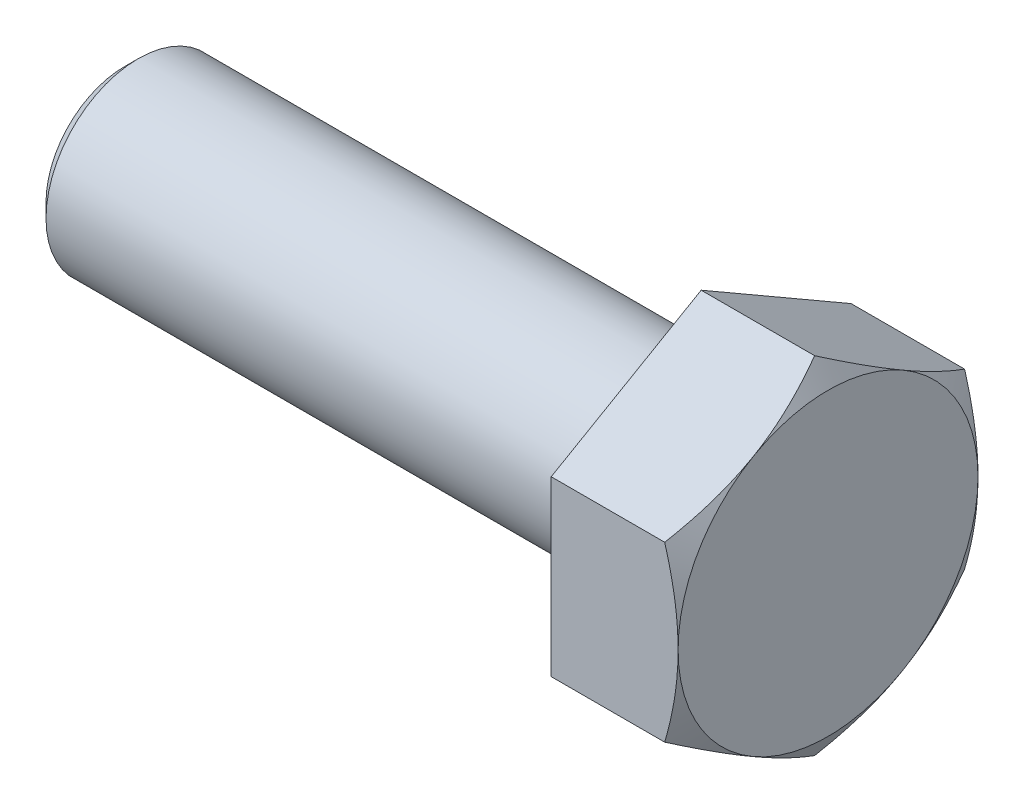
SolidWorks part; units mm, degrees
ref_plane "Plan1" through (0, 0, 0) normal (0, 0, 1) x (1, 0, 0)
ref_plane "Plan2" through (0, 0, 0) normal (0, 1, 0) x (1, 0, 0)
ref_plane "Plan3" through (0, 0, 0) normal (1, 0, 0) x (0, 0, -1)
sketch "Esquisse1" plane through (0, 0, 0) normal (0, 0, 1) x (1, 0, 0)
  line L0 (0, 0) -> (-25, 0)
  line L1 (-25, 0) -> (-25, 4)
  line L2 (-25, 4) -> (0, 4)
  line L3 (0, 4) -> (0, 0)
  line L4 (-110, 0) -> (30, 0) construction
  dimension "D1" = 25
  dimension "D2" = 4
revolve "Tige" add sketch "Esquisse1"
chamfer "Chanfrein de tige" distance 0.6 angle 45
sketch "Esquisse2" plane through (0, 0, 0) normal (1, 0, 0) x (0, 0, -1)
  line L0 (0, 7.5056) -> (6.5, 3.7528)
  line L1 (6.5, 3.7528) -> (6.5, -3.7528)
  line L2 (6.5, -3.7528) -> (0, -7.5056)
  line L3 (0, -7.5056) -> (-6.5, -3.7528)
  line L4 (-6.5, -3.7528) -> (-6.5, 3.7528)
  line L5 (-6.5, 3.7528) -> (0, 7.5056)
  line L6 (0, 7.5056) -> (0, 0) construction
  line L7 (0, 0) -> (6.5, 3.7528) construction
  line L8 (0, 0) -> (6.5, -3.7528) construction
  line L9 (0, 0) -> (0, -7.5056) construction
  line L10 (0, 0) -> (-6.5, -3.7528) construction
  line L11 (0, 0) -> (-6.5, 3.7528) construction
  dimension "D1" = 13
extrude "Tête" add sketch "Esquisse2" along normal blind 5.5
sketch "Esquisse3" plane through (5.5, 0, 0) normal (1, 0, 0) x (0, 0, -1)
  line L0 (6.5, 3.7528) -> (6.5, -3.7528) construction
  circle A0 centre (0, 0) radius 6.5
sketch "Esquisse4" plane through (0, 0, 0) normal (0, 0, 1) x (1, 0, 0)
  line L0 (4.9194, 7.5056) -> (5.5, 7.5056)
  line L1 (5.5, 7.5056) -> (5.5, 6.5)
  line L2 (5.5, 6.5) -> (4.9194, 7.5056)
  line L3 (5.5, -6.5) -> (5.5, 6.5) construction
  line L4 (5.5, 7.5056) -> (0, 7.5056) construction
  line L5 (16, 0) -> (-7, 0) construction
  line L6 (-110, 0) -> (30, 0) construction
  dimension "D1" = 30
revolve "Chanfrein de tête" cut sketch "Esquisse4" angle 360 about L5
